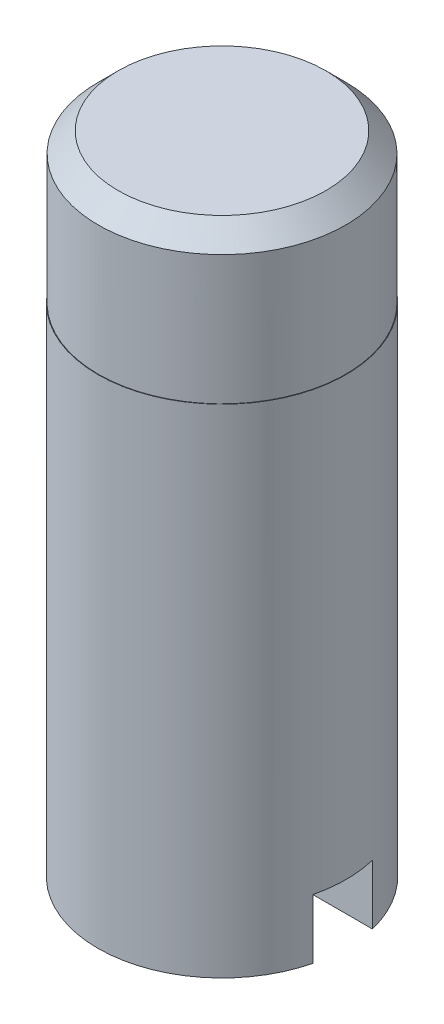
SolidWorks part; units mm, degrees
ref_plane "Front" through (0, 0, 0) normal (0, 0, 1) x (1, 0, 0)
ref_plane "Top" through (0, 0, 0) normal (0, 1, 0) x (1, 0, 0)
ref_plane "Right" through (0, 0, 0) normal (1, 0, 0) x (0, 0, -1)
sketch "Sketch1" plane through (0, 0, 0) normal (0, 1, 0) x (1, 0, 0)
  circle A0 centre (0, 0) radius 2.5
extrude "Extrude1" add sketch "Sketch1" along normal blind 10
sketch "Sketch2" plane through (0, 10, 0) normal (0, 1, 0) x (-1, 0, 0)
  circle A0 centre (0, 0) radius 2.49
extrude "Extrude2" add sketch "Sketch2" along normal blind 3
sketch "Sketch3" plane through (0, 0, 0) normal (0, -1, 0) x (1, 0, 0)
  line L1 (-6.0718, -0.6) -> (4.7441, -0.6)
  line L2 (-6.0718, 0.6) -> (4.7441, 0.6)
  line L3 (-6.0718, 0.6) -> (-6.0718, -0.6)
  line L4 (4.7441, 0.6) -> (4.7441, -0.6)
extrude "Cut-Extrude1" cut sketch "Sketch3" against normal blind 1.2
chamfer "Chamfer1" distance 0.4 1 edges at (0, 13, 2.49)
